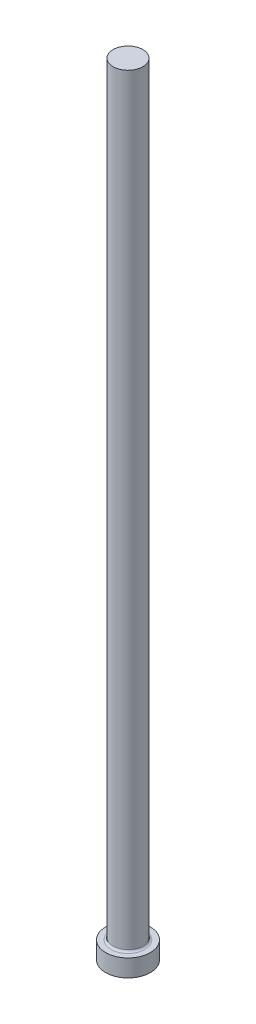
SolidWorks part; units mm, degrees
ref_plane "Plano frontal" through (0, 0, 0) normal (0, 0, 1) x (1, 0, 0)
ref_plane "Plano superior" through (0, 0, 0) normal (0, 1, 0) x (1, 0, 0)
ref_plane "Plano direito" through (0, 0, 0) normal (1, 0, 0) x (0, 0, -1)
sketch "Esboço1" plane through (0, 0, 0) normal (0, 0, 1) x (1, 0, 0)
  line L0 (0, 0) -> (9, 0)
  line L1 (9, 0) -> (9, 7)
  line L2 (9, 7) -> (6.8, 7)
  line L3 (6, 7.8) -> (6, 315)
  line L4 (6, 315) -> (0, 315)
  line L5 (0, 315) -> (0, 0) construction
  line L6 (0, 0) -> (0, 315)
  arc A0 (6.8, 7) -> (6, 7.8) centre (6.8, 7.8) cw
  dimension "D3" = 0.8
  dimension "D1" = 18
  dimension "D2" = 12
  dimension "D4" = 7
  dimension "D5" = 315
revolve "Revolução1" add sketch "Esboço1" angle 360 about L5
sketch "Esboço2"
  dimension "D1" = 1.0125
  dimension "D2" = 1.575
  dimension "D3" = 0.675
  dimension "D4" = 4.8375
wrap "Envolver1" sketch "Esboço2" wrap type deboss source sketch "Esboço2" thickness 0.1 parameters "D1"=0.1
